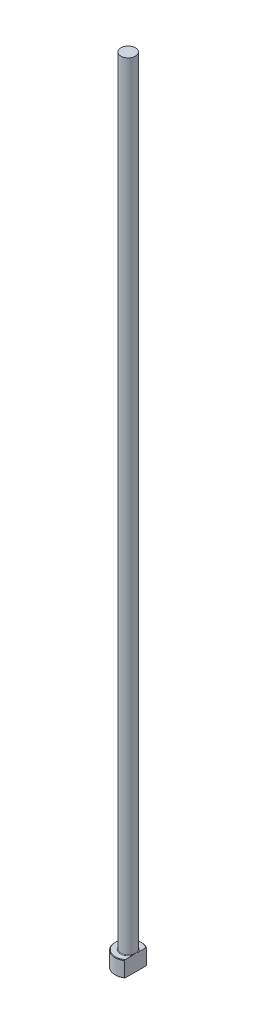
SolidWorks part; units mm, degrees
ref_plane "Front Plane" through (0, 0, 0) normal (0, 0, 1) x (1, 0, 0)
ref_plane "Top Plane" through (0, 0, 0) normal (0, 1, 0) x (1, 0, 0)
ref_plane "Right Plane" through (0, 0, 0) normal (1, 0, 0) x (0, 0, -1)
sketch "Sketch1" plane through (0, 0, 0) normal (0, 0, 1) x (1, 0, 0)
  line L0 (0, 259.9588) -> (0, -15.1925) construction
  line L1 (0, 0) -> (-5, 0)
  line L2 (-5, 0) -> (-5, 6)
  line L3 (-5, 6) -> (-2.75, 6)
  line L4 (-2.75, 6) -> (-2.75, 300)
  line L5 (-2.75, 300) -> (0, 300)
  line L6 (0, 300) -> (0, 0)
  dimension "L" = 300
  dimension "H" = 10
  dimension "T" = 6
  dimension "D" = 5.5
revolve "Revolve1" add sketch "Sketch1" angle 360 about L0
chamfer "Chamfer1" distance 0.2 angle 45 2 edges at (0, 6, 5) (0, 0, 5)
fillet "Fillet1" radius 0.2 1 edges at (0, 6, 2.75)
sketch "Sketch2" plane through (0, 0, 0) normal (0, 1, 0) x (1, 0, 0)
  line L0 (2.75, -4.1758) -> (2.75, 4.1758)
  circle A0 centre (0, 0) radius 5 construction
  arc A1 (2.75, -4.1758) -> (2.75, 4.1758) centre (0, 0) ccw
  circle A2 centre (0, 0) radius 2.75 construction
extrude "KEYED HEAD" cut sketch "Sketch2" along normal through all
